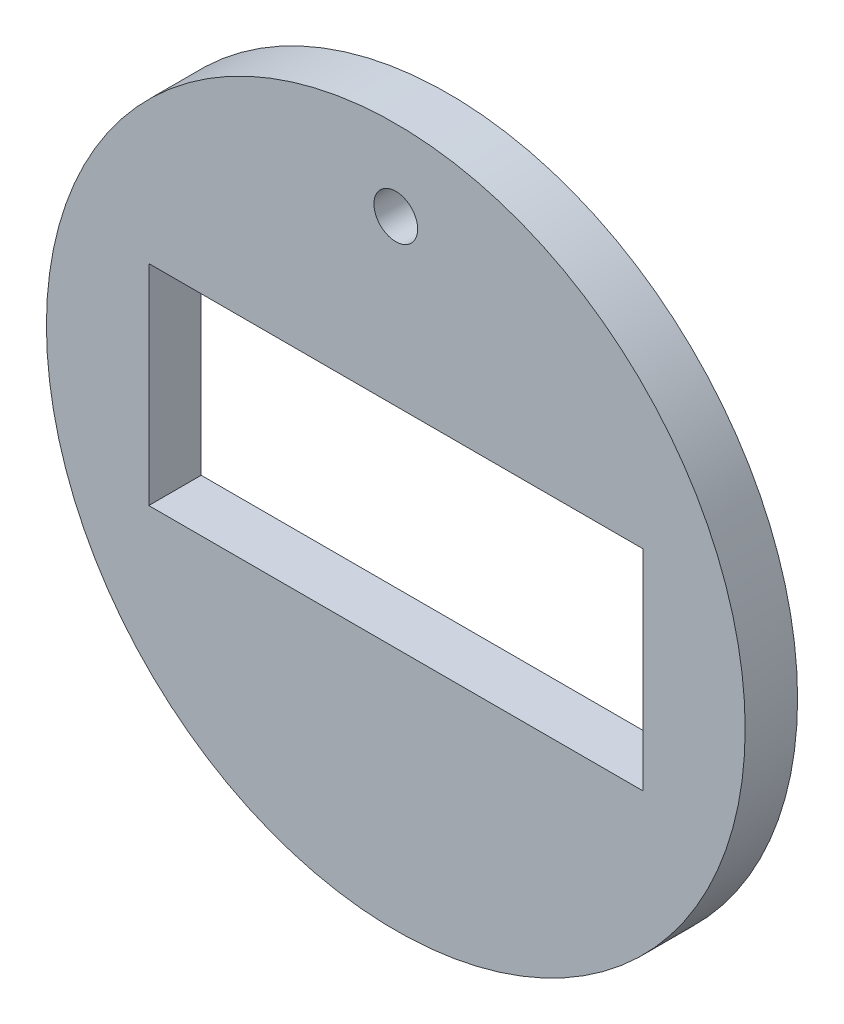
SolidWorks part; units mm, degrees
ref_plane "Front Plane" through (0, 0, 0) normal (0, 0, 1) x (1, 0, 0)
ref_plane "Top Plane" through (0, 0, 0) normal (0, 1, 0) x (1, 0, 0)
ref_plane "Right Plane" through (0, 0, 0) normal (1, 0, 0) x (0, 0, -1)
sketch "Sketch1" plane through (0, 0, 0) normal (0, 0, 1) x (1, 0, 0)
  circle A0 centre (0, 0) radius 25.4
  dimension "D1" = 50.8
extrude "Extrude1" add sketch "Sketch1" along normal blind 3.81
sketch "Sketch2" plane through (0, 0, 0) normal (0, 0, 1) x (1, 0, 0)
  circle A0 centre (0, 19.558) radius 1.5875
  dimension "D1" = 3.175
  dimension "D2" = 19.558
extrude "Cut-Extrude1" cut sketch "Sketch2" along normal through all
sketch "Sketch3" plane through (0, 0, 0) normal (0, 0, 1) x (1, 0, 0)
  line L0 (0, -28.7416) -> (0, 27.6728) construction
  line L1 (-25.4, 0) -> (25.4, 0) construction
  line L2 (-17.9578, 7.62) -> (17.9578, 7.62)
  line L3 (-17.9578, 7.62) -> (-17.9578, -7.62)
  line L4 (17.9578, 7.62) -> (17.9578, -7.62)
  line L5 (17.9578, -7.62) -> (-17.9578, -7.62)
  circle A0 centre (0, 0) radius 25.4 construction
  dimension "D1" = 35.9156
  dimension "D2" = 17.9578
  dimension "D3" = 15.24
  dimension "D4" = 7.62
extrude "Cut-Extrude2" cut sketch "Sketch3" along normal through all
